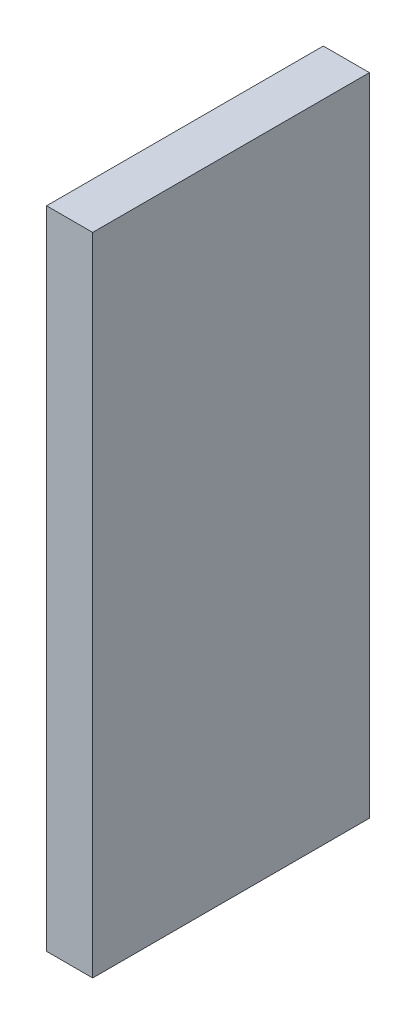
SolidWorks part; units mm, degrees
ref_plane "Front Plane" through (0, 0, 0) normal (0, 0, 1) x (1, 0, 0)
ref_plane "Top Plane" through (0, 0, 0) normal (0, 1, 0) x (1, 0, 0)
ref_plane "Right Plane" through (0, 0, 0) normal (1, 0, 0) x (0, 0, -1)
sketch "Sketch1" plane through (0, 0, 0) normal (0, 0, 1) x (1, 0, 0)
  line L0 (-32.5251, 273.05) -> (-45.2251, 273.05) construction
  line L1 (-32.5251, 184.15) -> (-38.8751, 184.15)
  line L2 (-32.5251, 184.15) -> (-32.5251, 273.05)
  line L3 (-32.5251, 273.05) -> (-38.8751, 273.05)
  line L4 (-38.8751, 184.15) -> (-38.8751, 273.05)
extrude "Boss-Extrude1" add sketch "Sketch1" along normal blind 38.1
